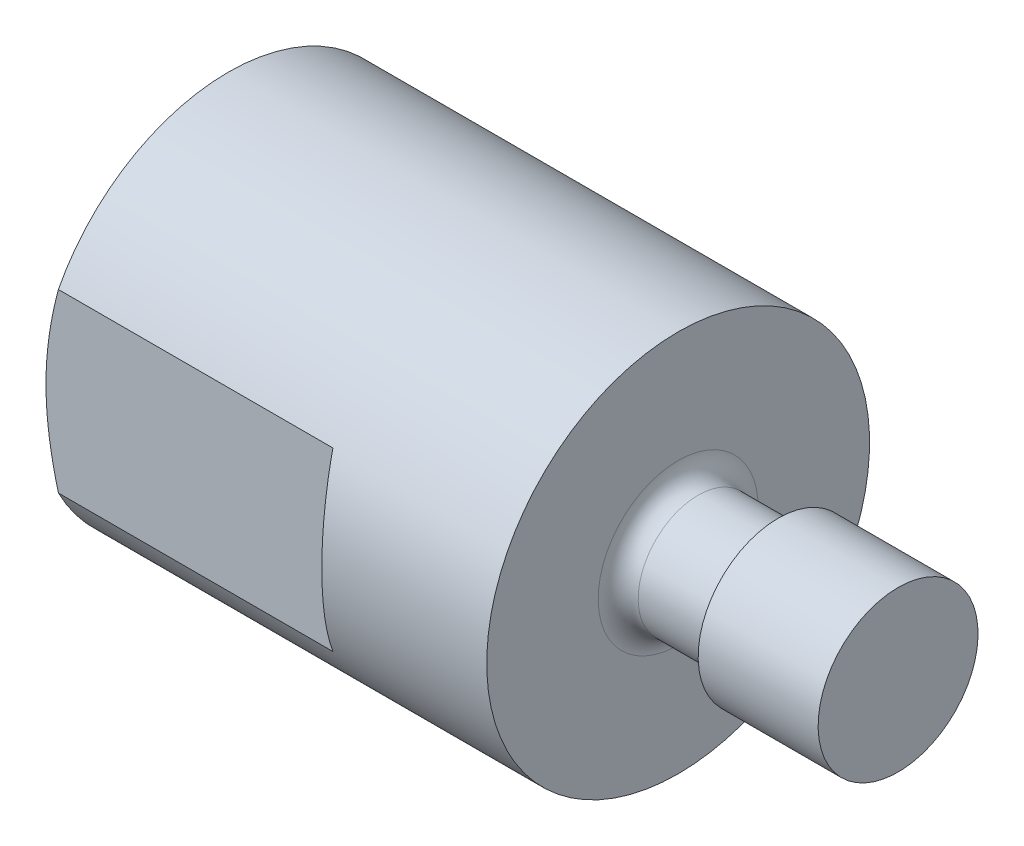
SolidWorks part; units mm, degrees
ref_plane "Plan de face" through (0, 0, 0) normal (0, 0, 1) x (1, 0, 0)
ref_plane "Plan de dessus" through (0, 0, 0) normal (0, 1, 0) x (1, 0, 0)
ref_plane "Plan de droite" through (0, 0, 0) normal (1, 0, 0) x (0, 0, -1)
sketch "Esquisse1" plane through (0, 0, 0) normal (0, 0, 1) x (1, 0, 0)
  line L0 (0, 0) -> (0, 7.8429)
  line L1 (0, 7.8429) -> (1, 9.575)
  line L2 (1, 9.575) -> (23.5, 9.575)
  line L3 (23.5, 9.575) -> (23.5, 3)
  line L4 (23.5, 3) -> (28.5, 3)
  line L5 (28.5, 3) -> (28.5, 4)
  line L6 (28.5, 4) -> (34.5, 4)
  line L7 (34.5, 4) -> (34.5, 0)
  line L8 (34.5, 0) -> (0, 0)
  dimension "D1" = 30
  dimension "D2" = 1
  dimension "D3" = 23.5
  dimension "D4" = 5
  dimension "D5" = 34.5
  dimension "D6" = 3
  dimension "D7" = 4
  dimension "D8" = 9.575
revolve "Révolution1" add sketch "Esquisse1" angle 360 about L8
fillet "Congé1" radius 1 1 edges at (23.5, 3, 0)
hole_wizard "Trou taraudé M10x1.02" positions "Esquisse3D2" profile "Esquisse3" tap size "M10x1.0" standard "Ansi Métrique"
sketch3d "Esquisse3D2"
  point P0 (0, 0, 0)
sketch "Esquisse3" plane through (0, 0, 0) normal (0, 1, 0) x (0, 0, 1)
  line L0 (0, 0) -> (0, 19.7039)
  line L1 (0, 19.7039) -> (4.5, 17)
  line L2 (4.5, 17) -> (4.5, 0)
  line L5 (4.5, 0) -> (0, 0)
  line L10 (0, 19.7039) -> (-4.5, 17) construction
  line L11 (0, -6.35) -> (0, 107.95) construction
  dimension "Diamètre du trou pour taraudage" = 9
  dimension "Profondeur du trou pour taraudage" = 17
  dimension "Angle de pointe" = 118
ref_plane "Plan1" through (0, 0, 9.575) normal (0, 0, 1) x (1, 0, 0)
sketch "Esquisse4" plane through (0, 0, 9.575) normal (0, 0, 1) x (1, 0, 0)
  circle A0 centre (-3.75, 0) radius 19
  dimension "D1" = 38
  dimension "D2" = 3.75
extrude "Extrusion1" cut sketch "Esquisse4" against normal blind 1.075
mirror "Symétrie1" about plane through (0, 0, 0) normal (0, 0, 1) of "Extrusion1"
chamfer "Chanfrein1" distance 1 angle 45 1 edges at (0, 0, 4.5)
